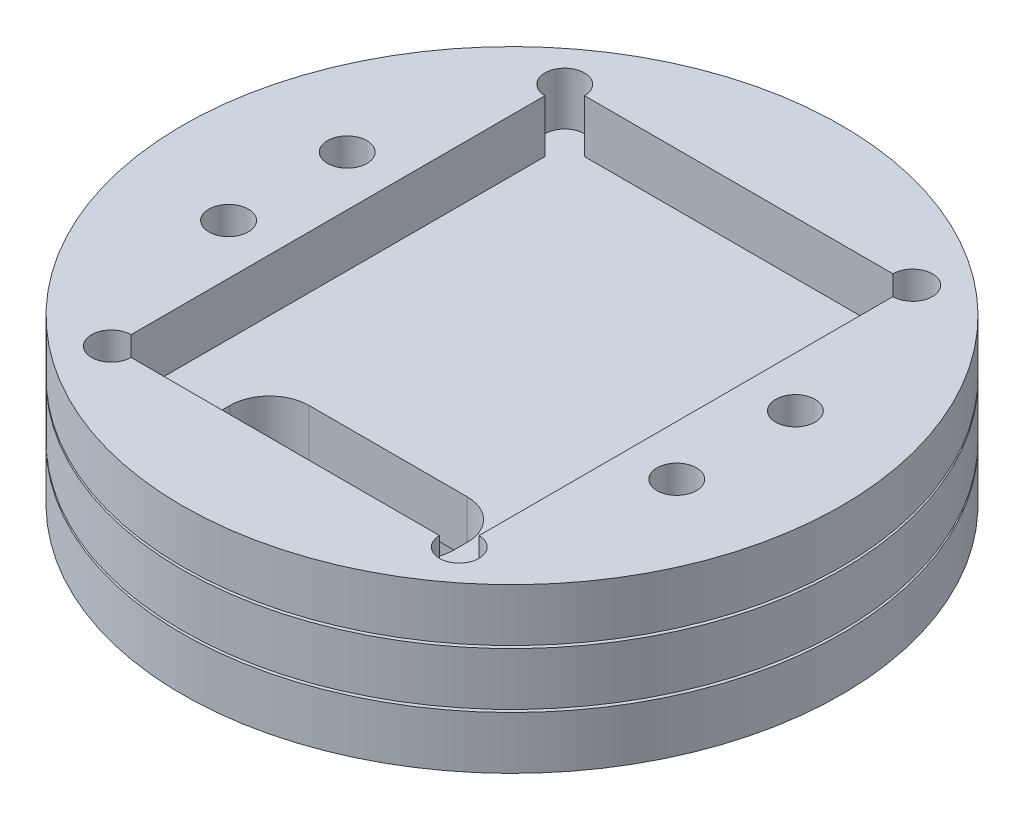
SolidWorks part; units mm, degrees
ref_plane "Front Plane" through (0, 0, 0) normal (0, 0, 1) x (1, 0, 0)
ref_plane "Top Plane" through (0, 0, 0) normal (0, 1, 0) x (1, 0, 0)
ref_plane "Right Plane" through (0, 0, 0) normal (1, 0, 0) x (0, 0, -1)
sketch "Sketch1" plane through (0, 0, 0) normal (0, 1, 0) x (1, 0, 0)
  line L1 (-0.762, -1.5748) -> (0.762, -1.7018) construction
  line L2 (-0.762, -2.0828) -> (0.762, -2.0828)
  line L3 (-1.143, -1.7018) -> (-1.143, -1.5748)
  line L4 (-0.762, -1.1938) -> (0.762, -1.1938)
  line L5 (1.143, -1.7018) -> (1.143, -1.5748)
  line L6 (0, 0) -> (0, -1.6383) construction
  line L7 (0, -1.6383) -> (0, -2.667) construction
  line L8 (-1.27, -2.667) -> (1.27, -2.667) construction
  line L9 (-1.27, -2.667) -> (-1.27, -1.143) construction
  line L10 (-1.27, -1.143) -> (1.27, -1.143) construction
  line L11 (1.27, -2.667) -> (1.27, -1.143) construction
  line L12 (-1.27, -1.905) -> (-2.4839, -1.905) construction
  circle A0 centre (0, 0) radius 3.175
  arc A1 (0.762, -2.0828) -> (1.143, -1.7018) centre (0.762, -1.7018) ccw
  arc A2 (0.762, -1.1938) -> (1.143, -1.5748) centre (0.762, -1.5748) cw
  arc A3 (-1.143, -1.5748) -> (-0.762, -1.1938) centre (-0.762, -1.5748) cw
  arc A4 (-0.762, -2.0828) -> (-1.143, -1.7018) centre (-0.762, -1.7018) cw
  dimension "D1" = 6.35
  dimension "D3" = 0.381
  dimension "D2" = 1.143
  dimension "D4" = 0.889
  dimension "D5" = 1.1938
  dimension "D6" = 2.286
  dimension "D7" = 1.524
  dimension "D8" = 2.54
extrude "Extrude1" add sketch "Sketch1" along normal blind 0.508
sketch "Sketch2" plane through (0, 0.508, 0) normal (0, 1, 0) x (1, 0, 0)
  line L1 (-2.159, 0.5715) -> (2.159, 0.5715) construction
  line L2 (-2.159, 0.5715) -> (-2.159, -0.5715) construction
  line L3 (-2.159, -0.5715) -> (2.159, -0.5715) construction
  line L4 (2.159, 0.5715) -> (2.159, -0.5715) construction
  line L5 (-2.159, 0.5715) -> (2.159, -0.5715) construction
  line L6 (-2.159, -0.5715) -> (2.159, 0.5715) construction
  circle A0 centre (2.159, -0.5715) radius 0.1905
  circle A1 centre (-2.159, -0.5715) radius 0.1905
  circle A2 centre (2.159, 0.5715) radius 0.1905
  circle A3 centre (-2.159, 0.5715) radius 0.1905
  point P3 (0, 0)
  dimension "D2" = 0.381
  dimension "D1" = 4.318
  dimension "D3" = 1.143
extrude "Extrude2" cut sketch "Sketch2" against normal through all
sketch "Sketch5" plane through (0, 0, 0) normal (0, -1, 0) x (1, 0, 0)
  line L0 (-1.4478, 0.7239) -> (-1.4478, 0.4191) construction
  line L1 (-0.762, 2.0828) -> (0.762, 2.0828) construction
  line L2 (-0.3175, 2.0828) -> (0.3175, 2.0828)
  line L3 (-0.3175, 2.0828) -> (-0.3175, 2.8956)
  line L4 (-0.3175, 2.8956) -> (0.762, 2.8956)
  line L5 (-1.8098, 0.4191) -> (-1.143, 0.4191)
  line L6 (0.3175, 2.0828) -> (0.3175, 2.5908)
  line L7 (-0.5969, 2.0828) -> (-0.3175, 2.0828) construction
  line L8 (0.5969, 2.0828) -> (0.762, 2.0828)
  line L9 (0.5969, 2.0828) -> (0.5969, 2.3876)
  line L10 (0.5969, 2.3876) -> (0.762, 2.3876)
  line L11 (1.143, 1.7018) -> (1.143, -0.7239)
  line L12 (0.762, 2.0828) -> (0.762, 2.3876) construction
  line L13 (1.4478, 1.7018) -> (1.4478, -0.4191)
  line L14 (1.8098, -0.7239) -> (1.143, -0.7239)
  line L15 (1.4478, -0.4191) -> (1.4478, -0.7239) construction
  line L16 (0.3175, 2.0828) -> (0.5969, 2.0828) construction
  line L17 (0, 2.0828) -> (0, 1.6383) construction
  line L18 (1.8098, -0.4191) -> (1.4478, -0.4191)
  line L19 (1.143, 1.7018) -> (1.4478, 1.7018) construction
  line L20 (1.4478, -0.5715) -> (2.159, -0.5715) construction
  line L21 (-2.159, -0.1905) -> (-1.143, -0.1905)
  line L22 (0.762, 2.5908) -> (0.3175, 2.5908)
  line L23 (-1.4478, 0.5715) -> (-2.159, 0.5715) construction
  line L25 (1.651, 1.7018) -> (1.651, 0.4191)
  line L26 (1.651, 0.4191) -> (1.8098, 0.4191)
  line L27 (1.9558, 1.7018) -> (1.9558, 0.8938)
  line L29 (1.651, 1.7018) -> (1.9558, 1.7018) construction
  line L31 (0.3175, 2.5908) -> (0.3175, 2.8956) construction
  line L32 (0.5969, 2.3876) -> (0.5969, 2.5908) construction
  line L33 (-1.8098, 0.7239) -> (-1.4478, 0.7239)
  line L35 (-1.143, -0.1905) -> (-1.143, -1.27)
  line L36 (-1.143, 0.4191) -> (-1.143, 1.7018)
  line L37 (-1.143, -1.27) -> (2.1997, -1.27)
  line L38 (-1.4478, 0.7239) -> (-1.4478, 1.7018)
  line L39 (-0.5969, 2.0828) -> (-0.762, 2.0828)
  line L40 (-0.5969, 2.0828) -> (-0.5969, 2.3876)
  line L41 (-0.5969, 2.3876) -> (-0.762, 2.3876)
  arc A0 (1.143, 1.7018) -> (0.762, 2.0828) centre (0.762, 1.7018) ccw construction
  arc A1 (1.143, 1.7018) -> (0.762, 2.0828) centre (0.762, 1.7018) ccw
  arc A2 (0.762, 2.3876) -> (1.4478, 1.7018) centre (0.762, 1.7018) cw
  arc A3 (-0.762, 2.0828) -> (-1.143, 1.7018) centre (-0.762, 1.7018) ccw construction
  arc A4 (1.8098, -0.7239) -> (1.8098, -0.4191) centre (2.159, -0.5715) ccw
  arc A5 (-0.762, 2.0828) -> (-1.143, 1.7018) centre (-0.762, 1.7018) ccw
  circle A6 centre (2.159, -0.5715) radius 0.1905 construction
  circle A7 centre (-2.159, 0.5715) radius 0.1905 construction
  circle A8 centre (-2.159, 0.5715) radius 0.1905
  circle A9 centre (2.159, -0.5715) radius 0.1905
  arc A10 (1.651, 1.7018) -> (0.762, 2.5908) centre (0.762, 1.7018) ccw
  arc A11 (1.9558, 1.7018) -> (0.762, 2.8956) centre (0.762, 1.7018) ccw
  circle A12 centre (2.159, 0.5715) radius 0.1905 construction
  circle A13 centre (2.159, 0.5715) radius 0.1905
  arc A14 (1.8098, 0.4191) -> (1.9558, 0.8938) centre (2.159, 0.5715) ccw
  arc A15 (-1.8098, 0.7239) -> (-1.8098, 0.4191) centre (-2.159, 0.5715) ccw
  arc A16 (-1.4478, 1.7018) -> (-0.762, 2.3876) centre (-0.762, 1.7018) cw
  circle A17 centre (-2.159, -0.5715) radius 0.1905 construction
  circle A18 centre (-2.159, -0.5715) radius 0.1905
  arc A19 (-2.159, -0.1905) -> (-2.3827, -0.8799) centre (-2.159, -0.5715) ccw
  arc A20 (-2.3827, -0.8799) -> (2.1997, -1.27) centre (0, 0) ccw
  dimension "D2" = 0.9144
  dimension "D4" = 0.2032
  dimension "D5" = 0.762
  dimension "D6" = 2.54
  dimension "D1" = 0.635
  dimension "D3" = 0.3048
  dimension "D7" = 1.27
extrude "Extrude5" add sketch "Sketch5" along normal blind 0.0254
sketch "Sketch10" plane through (0, 0.508, 0) normal (0, 1, 0) x (1, 0, 0)
  line L0 (1.6764, 2.1844) -> (-1.6764, -2.1844) construction
  line L1 (1.4859, -2.1844) -> (-1.4859, -2.1844)
  line L2 (1.6764, -1.9939) -> (1.6764, 1.9939)
  line L3 (1.4859, 2.1844) -> (-1.4859, 2.1844)
  line L4 (-1.6764, -1.9939) -> (-1.6764, 1.9939)
  arc A0 (-1.6764, -1.9939) -> (-1.4859, -2.1844) centre (-1.6764, -2.1844) ccw
  arc A1 (1.4859, -2.1844) -> (1.6764, -1.9939) centre (1.6764, -2.1844) ccw
  arc A2 (1.6764, 1.9939) -> (1.4859, 2.1844) centre (1.6764, 2.1844) ccw
  arc A3 (-1.4859, 2.1844) -> (-1.6764, 1.9939) centre (-1.6764, 2.1844) ccw
  dimension "D3" = 0.381
  dimension "D1" = 4.3688
  dimension "D2" = 3.3528
extrude "DiePocket" [suppressed] cut sketch "Sketch10" against normal blind 0.127
sketch "Sketch11" plane through (0, -0.0254, 0) normal (0, -1, 0) x (1, 0, 0)
  line L0 (-1.27, 2.667) -> (-1.27, 1.143) construction
  line L1 (-1.27, 2.667) -> (1.27, 2.667) construction
  line L2 (-1.27, 1.143) -> (1.27, 1.143) construction
  line L3 (1.27, 2.667) -> (1.27, 1.143) construction
  line L4 (-1.27, 2.286) -> (-1.27, 1.524)
  line L5 (-0.889, 2.667) -> (0.889, 2.667)
  line L6 (-0.889, 1.143) -> (0.889, 1.143)
  line L7 (1.27, 2.286) -> (1.27, 1.524)
  circle A0 centre (0, 0) radius 3.175 construction
  circle A1 centre (0, 0) radius 3.175
  arc A2 (0.889, 2.667) -> (1.27, 2.286) centre (0.889, 2.286) cw
  arc A3 (0.889, 1.143) -> (1.27, 1.524) centre (0.889, 1.524) ccw
  arc A4 (-1.27, 1.524) -> (-0.889, 1.143) centre (-0.889, 1.524) ccw
  arc A5 (-1.27, 2.286) -> (-0.889, 2.667) centre (-0.889, 2.286) cw
  circle A6 centre (-2.159, 0.5715) radius 0.1905
  circle A7 centre (-2.159, -0.5715) radius 0.1905
  circle A8 centre (2.159, 0.5715) radius 0.1905
  circle A9 centre (2.159, -0.5715) radius 0.1905
  circle A10 centre (2.159, 0.5715) radius 0.1905 construction
  dimension "D1" = 0.381
  dimension "D2" = 0.381
extrude "Boss-Extrude1" add sketch "Sketch11" along normal blind 0.508
sketch "Sketch12" [suppressed] plane through (0, -0.0254, 0) normal (0, 1, 0) x (1, 0, 0)
  circle A0 centre (0, 0) radius 3.175 construction
  circle A1 centre (0, 0) radius 3.175
extrude "Cut-Extrude1" [suppressed] cut sketch "Sketch12" along normal through all
sketch "Sketch13" [suppressed] plane through (0, -0.8128, 0) normal (0, -1, 0) x (1, 0, 0)
  line L2 (0, 0) -> (0, 0.8192) construction
  line L4 (0, 0) -> (-1.693, 0) construction
  line L5 (0, 0) -> (0, 1.6383) construction
  circle A1 centre (-2.159, -0.5715) radius 0.1905 construction
  circle A2 centre (-2.159, 0.5715) radius 0.1905 construction
  circle A4 centre (2.159, 0.5715) radius 0.1905 construction
  circle A5 centre (2.159, -0.5715) radius 0.1905 construction
  circle A6 centre (-2.159, -0.5715) radius 0.1905
  circle A8 centre (-2.159, 0.5715) radius 0.1905
  circle A9 centre (2.159, 0.5715) radius 0.1905
  circle A10 centre (2.159, -0.5715) radius 0.1905
extrude "Cut-Extrude2" [suppressed] cut sketch "Sketch13" against normal through all
sketch "Sketch14" plane through (0, -0.5334, 0) normal (0, -1, 0) x (1, 0, 0)
  circle A1 centre (-2.159, 0.5715) radius 0.381
  circle A2 centre (-2.159, -0.5715) radius 0.381
  circle A3 centre (2.159, -0.5715) radius 0.381
  circle A4 centre (2.159, 0.5715) radius 0.381
  circle A5 centre (-2.159, 0.5715) radius 0.1905 construction
  circle A6 centre (-2.159, -0.5715) radius 0.1905 construction
  circle A7 centre (2.159, -0.5715) radius 0.1905 construction
  circle A8 centre (2.159, 0.5715) radius 0.1905 construction
  circle A9 centre (-2.159, 0.5715) radius 0.1905
  circle A10 centre (-2.159, -0.5715) radius 0.1905
  circle A11 centre (2.159, -0.5715) radius 0.1905
  circle A12 centre (2.159, 0.5715) radius 0.1905
extrude "Boss-Extrude2" add sketch "Sketch14" along normal blind 0.0254
sketch "Sketch15" plane through (0, 0.508, 0) normal (0, 1, 0) x (1, 0, 0)
  line L4 (-1.4859, -2.1844) -> (1.4859, -2.1844)
  line L5 (-1.6764, 1.9939) -> (-1.6764, -1.9939)
  line L6 (1.4859, 2.1844) -> (-1.4859, 2.1844)
  line L7 (1.6764, -1.9939) -> (1.6764, 1.9939)
  line L8 (-1.4859, -2.1844) -> (1.4859, -2.1844)
  line L9 (-1.6764, 1.9939) -> (-1.6764, -1.9939)
  line L10 (1.4859, 2.1844) -> (-1.4859, 2.1844)
  line L11 (1.6764, -1.9939) -> (1.6764, 1.9939)
  circle A0 centre (-2.159, 0.5715) radius 0.1905 construction
  circle A1 centre (-2.159, 0.5715) radius 0.1905
  circle A2 centre (-2.159, -0.5715) radius 0.1905 construction
  circle A3 centre (2.159, 0.5715) radius 0.1905 construction
  arc A4 (-1.6764, -1.9939) -> (-1.4859, -2.1844) centre (-1.6764, -2.1844) ccw
  arc A5 (-1.4859, 2.1844) -> (-1.6764, 1.9939) centre (-1.6764, 2.1844) ccw
  arc A6 (1.6764, 1.9939) -> (1.4859, 2.1844) centre (1.6764, 2.1844) ccw
  arc A7 (1.4859, -2.1844) -> (1.6764, -1.9939) centre (1.6764, -2.1844) ccw
  arc A8 (-1.6764, -1.9939) -> (-1.4859, -2.1844) centre (-1.6764, -2.1844) ccw
  arc A9 (-1.4859, 2.1844) -> (-1.6764, 1.9939) centre (-1.6764, 2.1844) ccw
  arc A10 (1.6764, 1.9939) -> (1.4859, 2.1844) centre (1.6764, 2.1844) ccw
  arc A11 (1.4859, -2.1844) -> (1.6764, -1.9939) centre (1.6764, -2.1844) ccw
  circle A12 centre (2.159, -0.5715) radius 0.1905 construction
  circle A13 centre (-2.159, -0.5715) radius 0.1905
  circle A14 centre (2.159, 0.5715) radius 0.1905
  circle A15 centre (2.159, -0.5715) radius 0.1905
  circle A16 centre (0, 0) radius 3.175 construction
  circle A17 centre (0, 0) radius 3.175
  dimension "D1" = 0
extrude "Boss-Extrude3" add sketch "Sketch15" along normal blind 0.508 from offset 0.0254
sketch "Sketch16" [suppressed] plane through (0, 0.5334, 0) normal (0, -1, 0) x (1, 0, 0)
  circle A0 centre (0, 0) radius 3.175 construction
  circle A1 centre (0, 0) radius 3.175
extrude "Cut-Extrude3" [suppressed] cut sketch "Sketch16" along normal through all
